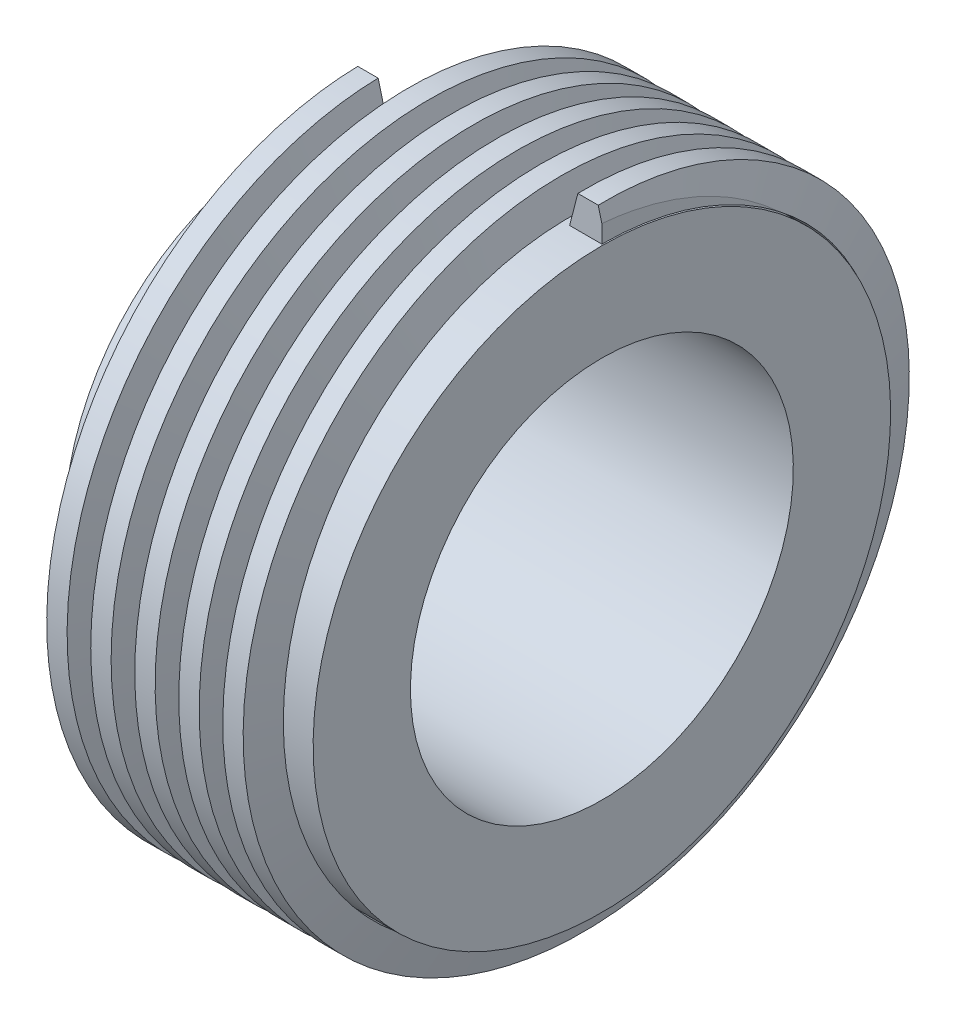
SolidWorks part; units mm, degrees
ref_plane "Front Plane" through (0, 0, 0) normal (0, 0, 1) x (1, 0, 0)
ref_plane "Top Plane" through (0, 0, 0) normal (0, 1, 0) x (1, 0, 0)
ref_plane "Right Plane" through (0, 0, 0) normal (1, 0, 0) x (0, 0, -1)
sketch "Sketch3" plane through (0, 0, 0) normal (0, 0, 1) x (1, 0, 0)
  line L0 (0, 0) -> (0, 12.7)
  line L1 (0, 12.7) -> (3.048, 12.7)
  line L2 (5.588, 15.24) -> (5.588, 18.5039)
  line L3 (5.588, 18.5039) -> (18.288, 18.5039)
  line L4 (18.288, 18.5039) -> (18.288, 0)
  line L5 (18.288, 0) -> (0, 0)
  arc A0 (5.588, 15.24) -> (3.048, 12.7) centre (3.048, 15.24) cw
  point P9 (5.588, 12.7)
  dimension "D5" = 2.54
  dimension "D1" = 12.7
  dimension "D2" = 18.5039
  dimension "D3" = 18.288
  dimension "D4" = 12.7
revolve "Revolve1" add sketch "Sketch3" angle 360 about L5
sketch "Sketch6" plane through (18.288, 0, 0) normal (1, 0, 0) x (0, 0, -1)
  circle A1 centre (0, 0) radius 18.5039
  circle A2 centre (0, 0) radius 18.5039
  dimension "D1" = 0
curve "Helix/Spiral1"
sketch "Sketch7" plane through (18.288, 0, 0) normal (1, 0, 0) x (0, 0, -1)
  circle A0 centre (0, 0) radius 16.6624
  circle A1 centre (0, 0) radius 18.5039
  circle A2 centre (0, 0) radius 18.5039
  dimension "D1" = 0
  dimension "D2" = 1.8415
extrude "Cut-Extrude3" cut sketch "Sketch7" against normal blind 12.7
sketch "Sketch8" plane through (0, 0, 0) normal (0, 1, 0) x (1, 0, 0)
  line L0 (13.7268, 18.5811) -> (14.9028, 18.5811)
  line L1 (14.9028, 18.5811) -> (15.3791, 16.7396)
  line L2 (15.3791, 16.7396) -> (13.2505, 16.7396)
  line L3 (13.2505, 16.7396) -> (13.7268, 18.5811)
  line L4 (14.3148, 18.5811) -> (14.3148, 15.1042) construction
  dimension "D3" = 14.5
  dimension "D1" = 1.176
  dimension "D2" = 1.8415
  dimension "D4" = 14.5
sweep "Sweep1" add profiles "Sketch8" path "Helix/Spiral1"
sketch "Sketch9" plane through (0, 0, 0) normal (0, 1, 0) x (1, 0, 0)
  line L1 (18.288, -16.6624) -> (23.931, -16.6624)
  line L2 (18.288, -16.6624) -> (18.288, 19.8798)
  line L3 (18.288, 19.8798) -> (23.931, 19.8798)
  line L4 (23.931, -16.6624) -> (23.931, 19.8798)
extrude "Cut-Extrude4" cut sketch "Sketch9" along normal blind 25.4
sketch "Sketch11" plane through (0, 0, 0) normal (1, 0, 0) x (0, 0, -1)
  circle A2 centre (0, 0) radius 11.049
  circle A3 centre (0, 0) radius 11.049
  dimension "D1" = 1.651
extrude "Cut-Extrude7" cut sketch "Sketch11" along normal through all
sketch "Sketch12" plane through (18.288, 0, 0) normal (1, 0, 0) x (0, 0, -1)
  circle A2 centre (0, 0) radius 15.0114
  circle A3 centre (0, 0) radius 15.0114
  dimension "D1" = 1.651
